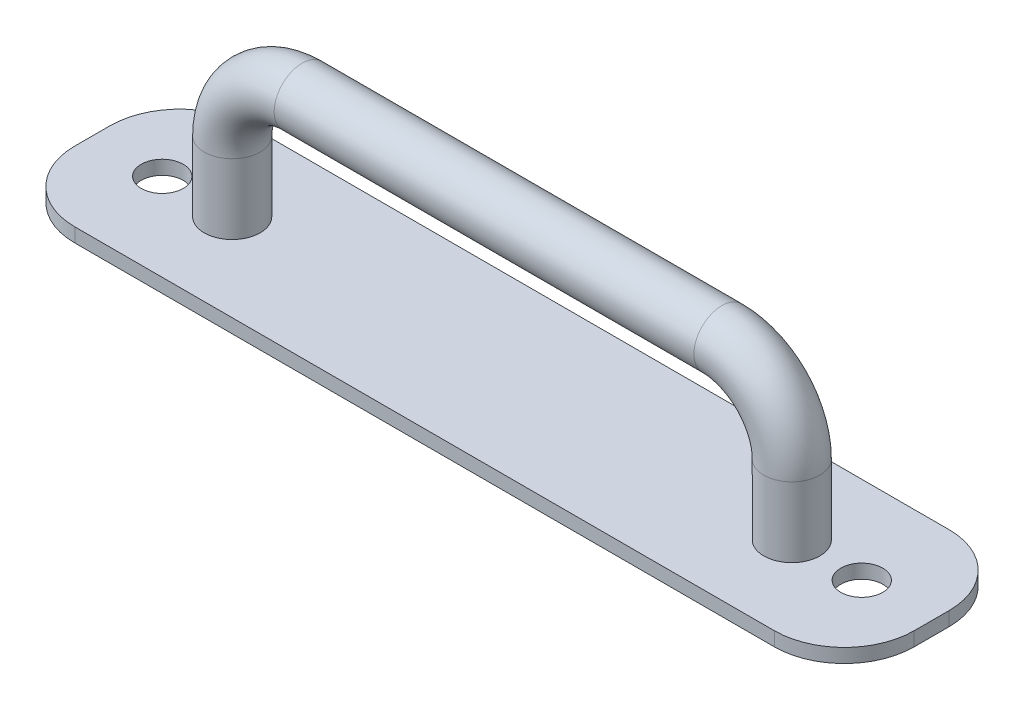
SolidWorks part; units mm, degrees
ref_plane "正面" through (0, 0, 0) normal (0, 0, 1) x (1, 0, 0)
ref_plane "平面" through (0, 0, 0) normal (0, 1, 0) x (1, 0, 0)
ref_plane "右側面" through (0, 0, 0) normal (1, 0, 0) x (0, 0, -1)
sketch "ｽｹｯﾁ1" plane through (0, 0, 0) normal (0, 1, 0) x (1, 0, 0)
  line L1 (-60, -12.5) -> (60, -12.5)
  line L2 (-60, -12.5) -> (-60, 12.5)
  line L3 (-60, 12.5) -> (60, 12.5)
  line L4 (60, -12.5) -> (60, 12.5)
  line L5 (-60, -12.5) -> (60, 12.5) construction
  line L6 (-60, 12.5) -> (60, -12.5) construction
  point P0 (0, 0)
  dimension "D1" = 120
  dimension "D2" = 25
extrude "ﾎﾞｽ - 押し出し1" add sketch "ｽｹｯﾁ1" along normal blind 2
sketch "ｽｹｯﾁ2" plane through (0, 0, 0) normal (0, 0, 1) x (1, 0, 0)
  line L0 (-40, 2) -> (-40, 12)
  line L1 (-30, 22) -> (30, 22)
  line L2 (40, 12) -> (40, 2)
  line L3 (-60, 2) -> (60, 2) construction
  arc A0 (30, 22) -> (40, 12) centre (30, 12) cw
  arc A1 (-40, 12) -> (-30, 22) centre (-30, 12) cw
  point P7 (0, 22)
  dimension "D1" = 10
  dimension "D2" = 80
  dimension "D3" = 20
sketch "ｽｹｯﾁ3" plane through (0, 2, 0) normal (0, 1, 0) x (1, 0, 0)
  circle A0 centre (-40, 0) radius 4
  dimension "D1" = 8
sweep "ｽｲｰﾌﾟ1" add profiles "ｽｹｯﾁ3" path "ｽｹｯﾁ2"
hole_wizard "Ø6.0 (6) 直径の穴1" positions "ｽｹｯﾁ4" profile "ｽｹｯﾁ6" hole size "Ø6.0" standard "JIS"
sketch "ｽｹｯﾁ4" plane through (0, 2, 0) normal (0, 1, 0) x (1, 0, 0)
  line L2 (0, 0) -> (0, 25.5115) construction
  point P8 (-50, 0)
  point P10 (50, 0)
  point P25 (0, 0)
  dimension "D1" = 100
sketch "ｽｹｯﾁ6" plane through (-50, 2, 0) normal (1, 0, 0) x (0, 0, 1)
  line L0 (0, 0) -> (0, 2)
  line L1 (0, 2) -> (3, 2)
  line L2 (3, 2) -> (3, 0)
  line L5 (3, 0) -> (0, 0)
  line L11 (0, -6.35) -> (0, 107.95) construction
  dimension "通し穴の直径" = 6
  dimension "通し穴の深さ" = 2
fillet "ﾌｨﾚｯﾄ1" radius 10 4 edges at (-60, 1, -12.5) (-60, 1, 12.5) (60, 1, -12.5) (60, 1, 12.5)
